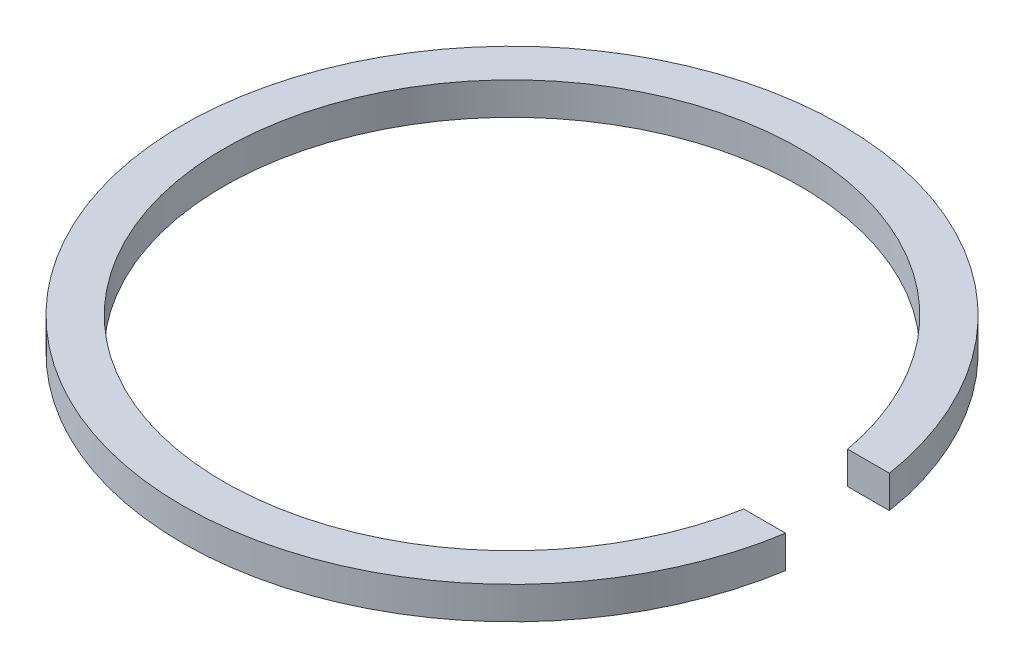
SolidWorks part; units mm, degrees
ref_plane "Front Plane" through (0, 0, 0) normal (0, 0, 1) x (1, 0, 0)
ref_plane "Top Plane" through (0, 0, 0) normal (0, 1, 0) x (1, 0, 0)
ref_plane "Right Plane" through (0, 0, 0) normal (1, 0, 0) x (0, 0, -1)
sketch "Sketch1" plane through (0, 0, 0) normal (0, 1, 0) x (1, 0, 0)
  line L0 (-55, 0) -> (55, 0) construction
  line L1 (10.931, 2) -> (12.5415, 2)
  line L2 (10.931, 2) -> (10.931, -2) construction
  line L3 (10.931, -2) -> (12.5415, -2)
  circle A0 centre (0, 0) radius 11.1125
  circle A1 centre (0, 0) radius 12.7
  point P8 (10.931, 0)
  dimension "D1" = 22.225
  dimension "D2" = 25.4
  dimension "D3" = 4
extrude "Boss-Extrude1" add sketch "Sketch1" along normal blind 1.25 contours L1 A1 L3 A0
